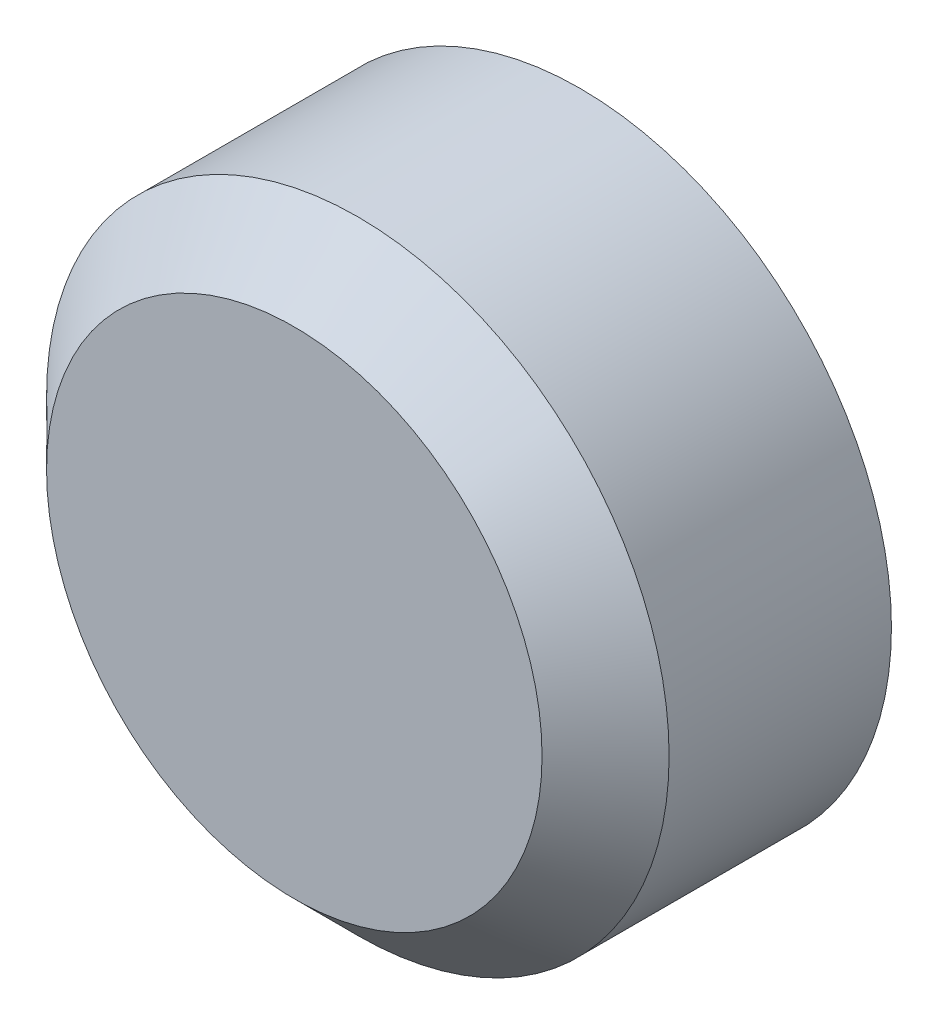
SolidWorks part; units mm, degrees
ref_plane "Front Plane" through (0, 0, 0) normal (0, 0, 1) x (1, 0, 0)
ref_plane "Top Plane" through (0, 0, 0) normal (0, 1, 0) x (1, 0, 0)
ref_plane "Right Plane" through (0, 0, 0) normal (1, 0, 0) x (0, 0, -1)
sketch "Sketch1" plane through (0, 0, 0) normal (0, 0, 1) x (1, 0, 0)
  circle A0 centre (0, 0) radius 9.8
  dimension "D1" = 19.6
extrude "Boss-Extrude1" add sketch "Sketch1" along normal blind 9
sketch "Sketch2" plane through (0, 0, 0) normal (0, 0, -1) x (-1, 0, 0)
  line L0 (-6.2875, 4.7) -> (6.2875, 4.7) construction
  line L1 (-6.2624, 4.65) -> (6.2624, 4.65)
  arc A0 (-6.2875, 4.7) -> (6.2875, 4.7) centre (0, 0) ccw construction
  arc A1 (-6.2624, 4.65) -> (6.2624, 4.65) centre (0, 0) ccw
  dimension "D1" = 15.7
  dimension "D2" = 4.7
  dimension "D3" = 0.05
extrude "Cut-Extrude1" cut sketch "Sketch2" against normal blind 6.5
chamfer "Chamfer1" distance 2 angle 45 1 edges at (9.8, 0, 9)
chamfer "Chamfer2" distance 0.5 angle 65 2 edges at (0, -7.8, 0) (0, 4.65, 0)
